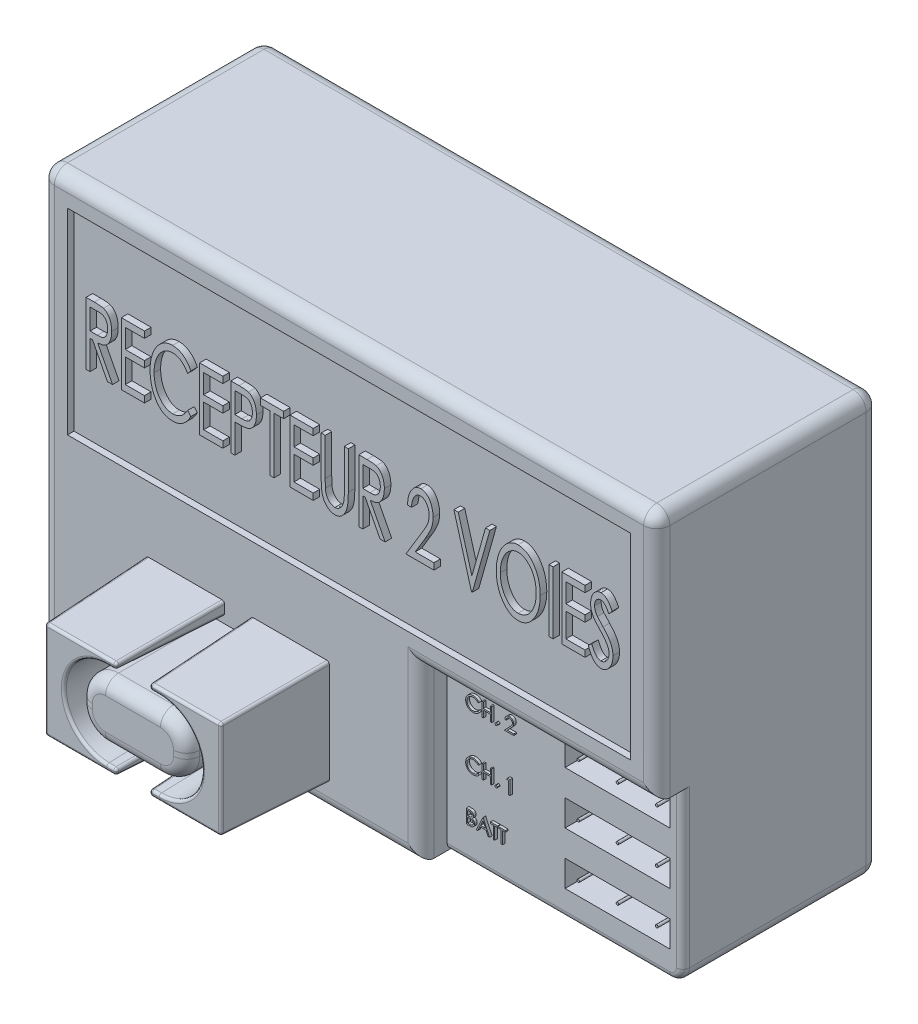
SolidWorks part; units mm, degrees
ref_plane "Plan de face" through (0, 0, 0) normal (0, 0, 1) x (1, 0, 0)
ref_plane "Plan de dessus" through (0, 0, 0) normal (0, 1, 0) x (1, 0, 0)
ref_plane "Plan de droite" through (0, 0, 0) normal (1, 0, 0) x (0, 0, -1)
sketch "Esquisse1" plane through (0, 0, 0) normal (0, 0, 1) x (1, 0, 0)
  line L1 (-23.5, 16) -> (23.5, 16)
  line L2 (-23.5, 16) -> (-23.5, -16)
  line L3 (-23.5, -16) -> (23.5, -16)
  line L4 (23.5, 16) -> (23.5, -16)
  dimension "D1" = 47
  dimension "D2" = 32
  dimension "D3" = 16
  dimension "D4" = 23.5
extrude "Extrusion1" add sketch "Esquisse1" along normal blind 17
sketch "Esquisse2" plane through (0, 0, 17) normal (0, 0, 1) x (1, 0, 0)
  line L0 (-9.5, -6) -> (-15.5, -6)
  line L1 (-15.5, -6) -> (-15.5, -14)
  line L2 (-15.5, -14) -> (-9.5, -14)
  line L3 (-9.5, -14) -> (-9.5, -13)
  line L4 (-9.5, -6) -> (-9.5, -7)
  line L5 (-9.5, -7) -> (-10.5, -7)
  line L6 (-9.5, -13) -> (-10.5, -13)
  line L7 (-23.5, 16) -> (-23.5, -16) construction
  line L8 (-23.5, -16) -> (23.5, -16) construction
  arc A0 (-10.5, -7) -> (-10.5, -13) centre (-10.5, -10) ccw
  dimension "D1" = 8
  dimension "D2" = 6
  dimension "D3" = 1
  dimension "D4" = 1
  dimension "D5" = 8
  dimension "D6" = 2
extrude "Extrusion2" add sketch "Esquisse2" along normal blind 8 draft 2
fillet "Congé2" radius 0.2 14 edges at (-10.1397, -6.7206, 25) (-13.7794, -10, 25) (-10.1397, -13.2794, 25) (-9.7794, -13.5, 25) (-12.5, -13.7206, 25) (-15.2206, -10, 25) (-12.5, -6.2794, 25) (-9.7794, -6.5, 25) (-9.6397, -6.8603, 21) (-9.6397, -13.1397, 21) (-9.6397, -13.8603, 21) (-15.3603, -13.8603, 21) (-9.6397, -6.1397, 21) (-15.3603, -6.1397, 21)
ref_plane "Plan1" through (-8.5, 0, 0) normal (-1, 0, 0) x (0, 0, 1)
mirror "Symétrie1" about plane through (-8.5, 0, 0) normal (-1, 0, 0) of "Congé2", "Extrusion2"
sketch "Esquisse3" plane through (0, 0, 17) normal (0, 0, 1) x (1, 0, 0)
  line L1 (23.5, -16) -> (5.5, -16)
  line L2 (23.5, -16) -> (23.5, -3)
  line L3 (23.5, -3) -> (5.5, -3)
  line L4 (5.5, -16) -> (5.5, -3)
  dimension "D1" = 18
  dimension "D2" = 13
extrude "Enlèv. mat.-Extru.1" cut sketch "Esquisse3" against normal blind 2
sketch "Esquisse4" plane through (0, 0, 15) normal (0, 0, 1) x (1, 0, 0)
  line L0 (23.5, -3) -> (5.5, -3) construction
  line L1 (22.5, -4) -> (14.5, -4)
  line L2 (22.5, -4) -> (22.5, -6)
  line L3 (22.5, -6) -> (14.5, -6)
  line L4 (14.5, -4) -> (14.5, -6)
  line L5 (23.5, -16) -> (23.5, -3) construction
  circle A0 centre (21.5, -5) radius 0.1
  circle A1 centre (18.5, -5) radius 0.1
  circle A2 centre (15.5, -5) radius 0.1
  dimension "D7" = 0.2
  dimension "D1" = 8
  dimension "D2" = 2
  dimension "D3" = 1
  dimension "D4" = 1
  dimension "D5" = 1
  dimension "D6" = 1
extrude "Enlèv. mat.-Extru.2" cut sketch "Esquisse4" against normal blind 8
pattern_linear "Répétition linéaire1" count 3 spacing 4 along (0, -1, 0) of "Enlèv. mat.-Extru.2"
fillet "Congé3" radius 1 14 edges at (0, -16, 0) (23.5, 0, 0) (0, 16, 0) (-23.5, 0, 0) (-23.5, 16, 8.5) (-23.5, -16, 8.5) (23.5, 16, 8.5) (23.5, -16, 7.5) (-9, -16, 17) (-23.5, 0, 17) (0, 16, 17) (23.5, 6.5, 17) (5.5, -9.5, 17) (14.5, -3, 17)
fillet "Congé4" radius 0.5 3 edges at (23.5, -9, 15) (23.2071, -15.7071, 15) (14, -16, 15)
sketch "Esquisse5" plane through (0, 0, 15) normal (0, 0, 1) x (1, 0, 0)
  text T0 "CH. 2" font "Century Gothic" height in points 4
  text T1 "CH. 1" font "Century Gothic" height in points 4
  text T2 "BATT" font "Century Gothic" height in points 4
extrude "Extrusion3" add sketch "Esquisse5" along normal blind 0.2
sketch "Esquisse6" plane through (0, 0, 17) normal (0, 0, 1) x (1, 0, 0)
  line L0 (-10.5, -7.5) -> (-6.5, -7.5)
  line L1 (-10.5, -12.5) -> (-6.5, -12.5)
  arc A0 (-10.5, -7.5) -> (-10.5, -12.5) centre (-10.5, -10) ccw
  arc A1 (-6.5, -7.5) -> (-6.5, -12.5) centre (-6.5, -10) cw
  circle A2 centre (-10.5, -10) radius 0.25
  circle A3 centre (-6.5, -10) radius 0.25
  dimension "D3" = 0.5
  dimension "D4" = 0.5
  dimension "D1" = 0.5
  dimension "D2" = 0.5
extrude "Enlèv. mat.-Extru.3" cut sketch "Esquisse6" against normal blind 8
sketch "Esquisse7" plane through (0, 0, 17) normal (0, 0, 1) x (1, 0, 0)
  line L0 (22.5, 15) -> (-22.5, 15) construction
  line L1 (-21.5, 14) -> (21.5, 14)
  line L2 (-21.5, 14) -> (-21.5, -1)
  line L3 (-21.5, -1) -> (21.5, -1)
  line L4 (21.5, 14) -> (21.5, -1)
  line L5 (-22.5, 15) -> (-22.5, -15) construction
  line L6 (4.5, -2) -> (22.5, -2) construction
  line L7 (22.5, -2) -> (22.5, 15) construction
  dimension "D1" = 1
  dimension "D2" = 1
  dimension "D3" = 1
  dimension "D4" = 1
extrude "Enlèv. mat.-Extru.4" cut sketch "Esquisse7" against normal blind 0.5
sketch "Esquisse8" plane through (0, 0, 16.5) normal (0, 0, 1) x (1, 0, 0)
  text T0 "RECEPTEUR 2 VOIES" font "Century Gothic" height in points 18
extrude "Extrusion4" add sketch "Esquisse8" along normal blind 0.5
sketch "Esquisse9" plane through (0, 0, 9) normal (0, 0, 1) x (1, 0, 0)
  line L0 (-6.5, -7.5) -> (-10.5, -7.5) construction
  line L1 (-10.6, -7.8) -> (-6.4, -7.8)
  line L2 (-12.6, -9.8) -> (-12.6, -10.2)
  line L3 (-10.6, -12.2) -> (-6.4, -12.2)
  line L4 (-4.4, -9.8) -> (-4.4, -10.2)
  line L5 (-10.5, -12.5) -> (-6.5, -12.5) construction
  arc A0 (-6.4, -7.8) -> (-4.4, -9.8) centre (-6.4, -9.8) cw
  arc A1 (-6.4, -12.2) -> (-4.4, -10.2) centre (-6.4, -10.2) ccw
  arc A2 (-12.6, -10.2) -> (-10.6, -12.2) centre (-10.6, -10.2) ccw
  arc A3 (-10.6, -7.8) -> (-12.6, -9.8) centre (-10.6, -9.8) ccw
  arc A5 (-6.5, -12.5) -> (-6.5, -7.5) centre (-6.5, -10) ccw construction
  arc A6 (-10.5, -7.5) -> (-10.5, -12.5) centre (-10.5, -10) ccw construction
  point P16 (-13, -10)
  point P19 (-4, -10)
  dimension "D1" = 2
  dimension "D2" = 0.3
  dimension "D3" = 0.3
  dimension "D4" = 4.2
  dimension "D5" = 0.4
extrude "Extrusion5" add sketch "Esquisse9" along normal blind 16
fillet "Congé5" radius 1 8 edges at (-4.4, -10, 25) (-4.9858, -11.6142, 25) (-8.5, -12.2, 25) (-12.0142, -11.6142, 25) (-12.6, -10, 25) (-12.0142, -8.3858, 25) (-8.5, -7.8, 25) (-4.9858, -8.3858, 25)
